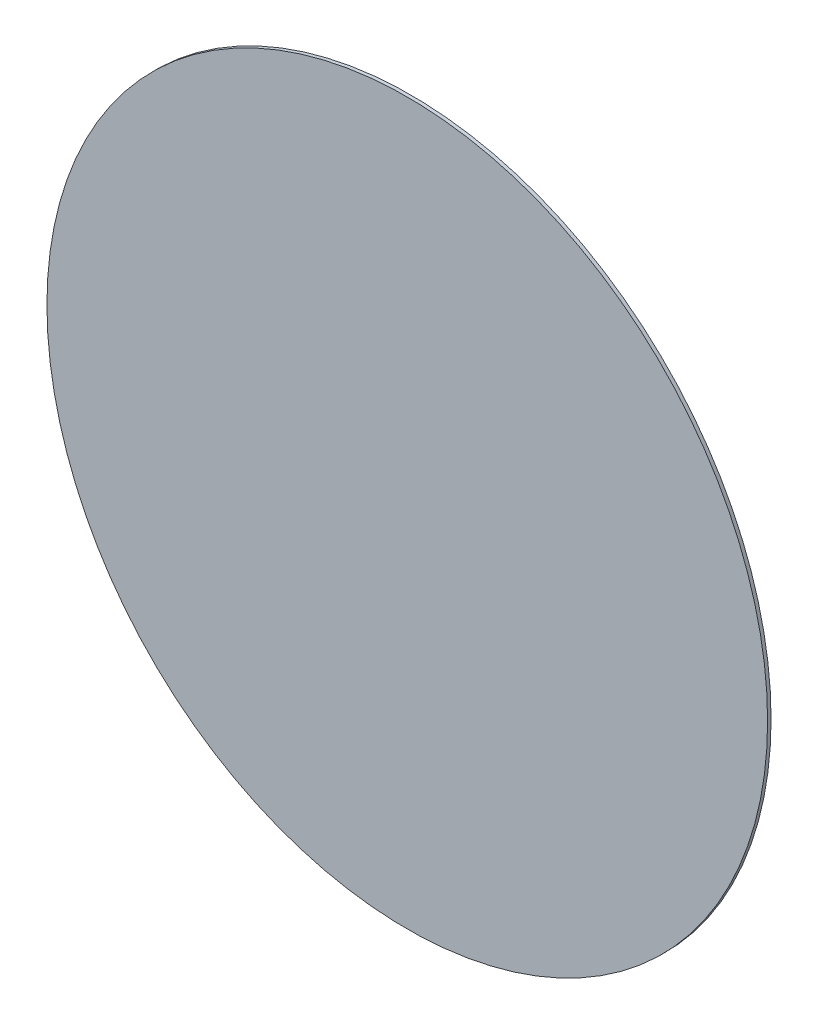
SolidWorks part; units mm, degrees
ref_plane "Front" through (0, 0, 0) normal (0, 0, 1) x (1, 0, 0)
ref_plane "Top" through (0, 0, 0) normal (0, 1, 0) x (1, 0, 0)
ref_plane "Right" through (0, 0, 0) normal (1, 0, 0) x (0, 0, -1)
sketch "Sketch1" plane through (0, 0, 0) normal (0, 0, 1) x (1, 0, 0)
  circle A0 centre (0, 0) radius 12.5
  dimension "D1" = 25
extrude "Extrude1" add sketch "Sketch1" along normal blind 0.12
